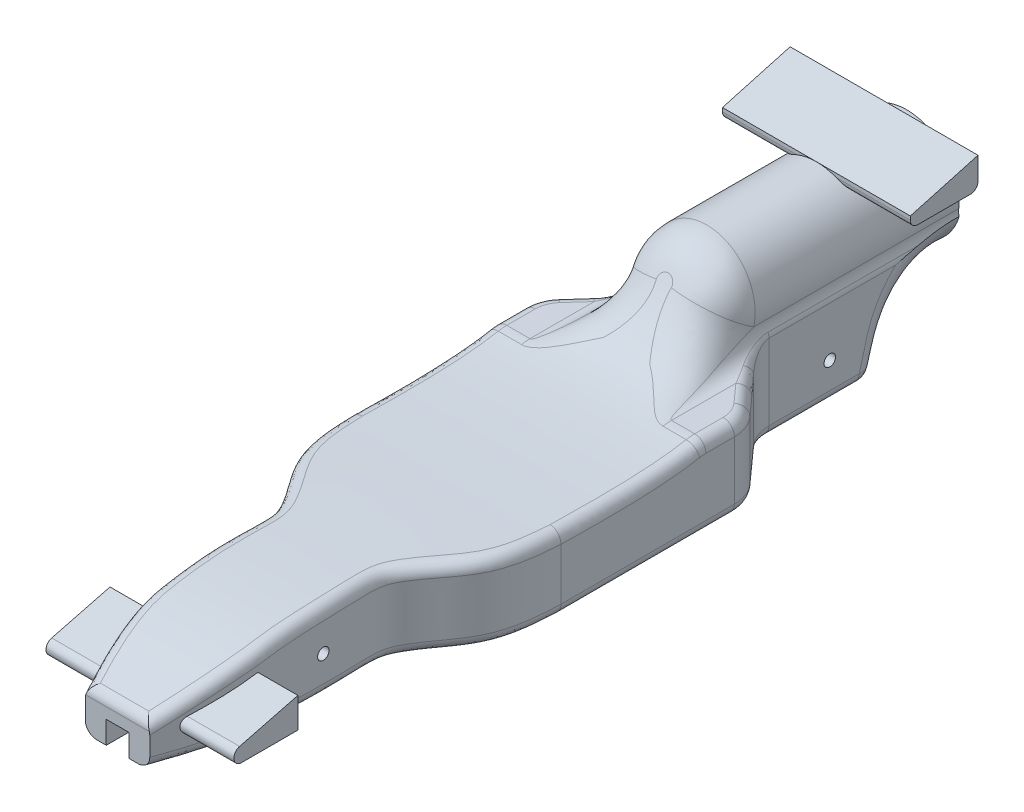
SolidWorks part; units mm, degrees
ref_plane "Front Plane" through (0, 0, 0) normal (0, 0, 1) x (1, 0, 0)
ref_plane "Top Plane" through (0, 0, 0) normal (0, 1, 0) x (1, 0, 0)
ref_plane "Right Plane" through (0, 0, 0) normal (1, 0, 0) x (0, 0, -1)
sketch "Sketch1" plane through (0, 0, 0) normal (0, 0, 1) x (1, 0, 0)
  line L1 (-32.5, 0) -> (32.5, 0)
  line L2 (-32.5, 0) -> (-32.5, 50)
  line L3 (-32.5, 50) -> (32.5, 50)
  line L4 (32.5, 0) -> (32.5, 50)
  dimension "D1" = 65
  dimension "D2" = 50
extrude "Balsa Block" add sketch "Sketch1" along normal blind 223
sketch "Sketch2" plane through (0, 0, 223) normal (0, 0, 1) x (1, 0, 0)
  line L0 (-32.5, 0) -> (32.5, 0) construction
  line L1 (-3, 0) -> (3, 0)
  line L2 (-3, 0) -> (-3, 6)
  line L3 (-3, 6) -> (3, 6)
  line L4 (3, 0) -> (3, 6)
  dimension "D1" = 6
  dimension "D2" = 6
extrude "Screw Eye Slot" cut sketch "Sketch2" against normal through all
sketch "Sketch3" plane through (0, 0, 0) normal (0, 0, -1) x (-1, 0, 0)
  line L0 (32.5, 0) -> (3, 0) construction
  circle A0 centre (0, 29) radius 9.55
  dimension "D1" = 19.1
  dimension "D2" = 29
extrude "CO2 Cartridge Hole" cut sketch "Sketch3" against normal blind 52
sketch "Sketch4" plane through (32.5, 0, 0) normal (1, 0, 0) x (0, 0, -1)
  line L0 (-223, 0) -> (0, 0) construction
  line L1 (0, 0) -> (0, 50) construction
  circle A0 centre (-170, 10) radius 1.525
  circle A1 centre (-35, 10) radius 1.525
  dimension "D4" = 3.05
  dimension "D1" = 10
  dimension "D2" = 135
  dimension "D3" = 35
extrude "Axle Hole Cut Out" cut sketch "Sketch4" against normal through all
sketch "Sketch5" plane through (0, 50, 0) normal (0, 1, 0) x (1, 0, 0)
  line L0 (32.5, 0) -> (-32.5, 0) construction
  line L1 (0, 0) -> (0, -229.7898) construction
  line L2 (-14.55, 0) -> (-14.55, -51.1732)
  line L3 (-17.1047, -57.8491) -> (-25.4453, -67.1509)
  line L4 (-28, -73.8268) -> (-28, -120)
  line L5 (-14.4879, 48.8908) -> (-14.4879, 49.7327) construction
  line L6 (28, -73.8268) -> (28, -120)
  line L7 (17.1047, -57.8491) -> (25.4453, -67.1509)
  line L8 (14.55, 0) -> (14.55, -51.1732)
  line L9 (-14.7766, 49.831) -> (-14.7766, 50.2789) construction
  line L10 (-9.55, 0) -> (-9.55, -52) construction
  line L11 (9.55, -52) -> (9.55, 0) construction
  arc A0 (-25.4453, -67.1509) -> (-28, -73.8268) centre (-18, -73.8268) ccw
  arc A1 (-14.55, -51.1732) -> (-17.1047, -57.8491) centre (-24.55, -51.1732) cw
  arc A2 (14.55, -51.1732) -> (17.1047, -57.8491) centre (24.55, -51.1732) ccw
  arc A3 (25.4453, -67.1509) -> (28, -73.8268) centre (18, -73.8268) cw
  spline S0 degree 3 poles (-28, -120) (-27.6859, -126.0056) (-27.1636, -135.9946) (-19.7034, -144.9636) (-13.3488, -154.8578) (-14.7766, -154.2092) (-14.7766, -173.3072) (-14.4879, -181.2754) (-14.4879, -195.7718) (-8.4397, -210.8954) (-2.3915, -226.019) knots 0 0 0 0 0.179945 0.299298 0.299298 0.625194 0.625194 0.690626 0.690626 1 1 1 1
  spline S1 degree 3 poles (28, -120) (27.6859, -126.0056) (27.1636, -135.9946) (19.7034, -144.9636) (13.3488, -154.8578) (14.7766, -154.2092) (14.7766, -173.3072) (14.4879, -181.2754) (14.4879, -195.7718) (8.4397, -210.8954) (2.3915, -226.019) knots 0 0 0 0 0.179945 0.299298 0.299298 0.625194 0.625194 0.690626 0.690626 1 1 1 1
  spline S2 degree 3 poles (-14.55, 0) (-14.55, -18.3333) (-14.55, -36.6667) (-14.55, -55) knots 0 0 0 0 1 1 1 1
  spline S3 degree 3 poles (14.55, 0) (14.55, -18.3333) (14.55, -36.6667) (14.55, -55) knots 0 0 0 0 1 1 1 1
  dimension "D2" = 5
  dimension "D1" = 5
sketch "Sketch6" plane through (0, 0, 0) normal (1, 0, 0) x (0, 0, -1)
  line L1 (-52, 19.45) -> (0, 19.45) construction
  line L3 (0, 35.543) -> (0, -35.543) construction
  line L10 (-210, 10.9116) -> (-210, 0)
  line L13 (-210, 0) -> (-22.7709, 0)
  spline S0 degree 3 poles (-210, 10.9116) (-202.7227, 13.8598) (-188.783, 19.5071) (-143.7313, 22.444) (-85.5632, 16.1988) (-63.4626, 33.1745) (-61.6089, 55.2214) (-24.8176, 48.2515) (0, 43.55) knots 0 0 0 0 0.060945 0.11674 0.333018 0.333018 0.550088 1 1 1 1
  spline S1 degree 3 poles (-22.7709, 0) (-21.942, 3.2613) (-20.3664, 9.4604) (-11.2641, 16.1435) (-4.1106, 15.068) (0, 14.45) knots 0 0 0 0 0.32075 0.609686 1 1 1 1
  dimension "D3" = 5
  dimension "D1" = 210
  dimension "D2" = 5
sketch "Sketch7" plane through (0, 0, 0) normal (0, 0, -1) x (-1, 0, 0)
  line L0 (18.8348, 21.5) -> (32.5, 21.5)
  line L2 (-18.8348, 21.5) -> (-32.5, 21.5)
  line L5 (0, 0) -> (0, 64.6236) construction
  arc A0 (13.8783, 27.1579) -> (-13.8783, 27.1579) centre (0, 29) ccw
  arc A1 (-13.8783, 27.1579) -> (-18.8348, 21.5) centre (-18.8348, 26.5) cw
  arc A2 (13.8783, 27.1579) -> (18.8348, 21.5) centre (18.8348, 26.5) ccw
  dimension "D1" = 14
  dimension "D3" = 5
  dimension "D2" = 21.5
  dimension "D4" = 65
sketch "Sketch8" plane through (0, 0, 0) normal (1, 0, 0) x (0, 0, -1)
  line L0 (-202.5076, 10) -> (-187, 14)
  line L1 (-187, 14) -> (-187, 6)
  line L2 (-187, 6) -> (-202, 6)
  line L3 (-210, 0) -> (-22.7709, 0) construction
  line L6 (-210, 10.9116) -> (-210, 0) construction
  arc A0 (-202.5076, 10) -> (-202, 6) centre (-202, 8.0322) ccw
  dimension "D1" = 15
  dimension "D2" = 6
  dimension "D3" = 8
  dimension "D4" = 10
  dimension "D5" = 8
extrude "Cut-Extrude1" cut sketch "Sketch5" against normal through all contours S0 L4 A0 L3 A1 L2 M33 M34 M35 | L6 S1 L8 A2 L7 A3 M35 M36 M33
extrude "Cut-Extrude2" cut sketch "Sketch6" against normal through all and the other way through all flip side to cut
extrude "Cut-Extrude3" cut sketch "Sketch7" against normal through all and the other way through all flip side to cut
extrude "Boss-Extrude1" add sketch "Sketch8" along normal mid plane 50
sketch "Sketch9" plane through (0, 0, 0) normal (1, 0, 0) x (0, 0, -1)
  line L0 (-24, 43) -> (-6, 48)
  line L1 (0, 43) -> (-59.8515, 43) construction
  line L2 (-6, 48) -> (-6, 42)
  line L3 (-8, 40) -> (-22, 40)
  line L4 (-24, 42) -> (-24, 43)
  line L5 (0, 27.1579) -> (0, 43) construction
  arc A0 (-6, 42) -> (-8, 40) centre (-8, 42) cw
  arc A1 (-22, 40) -> (-24, 42) centre (-22, 42) cw
  dimension "D1" = 2
  dimension "D2" = 3
  dimension "D3" = 8
  dimension "D4" = 18
  dimension "D5" = 6
extrude "Boss-Extrude2" add sketch "Sketch9" along normal mid plane 50
fillet "Fillet1" radius 3 29 edges at (-14.55, 0, 36.9721) (-15.2105, 0, 54.7472) (-21.275, 0, 62.5) (-27.3395, 0, 70.2528) (-28, 0, 96.9134) (15.2105, 0, 54.7472) (14.55, 0, 36.9721) (21.275, 0, 62.5) (27.3395, 0, 70.2528) (28, 0, 96.9134) (0, 10.9116, 210) (-14.55, 23.9231, 25.5866) (-14.7762, 23.5797, 53.2883) (-17.9561, 21.5778, 58.7986) (-22.14, 21.5, 63.4647) (-27.3395, 21.5, 70.2528) (-28, 21.5, 78.2147) (-15.33, 20.6441, 152.4527) (14.55, 23.9231, 25.5866) (14.7762, 23.5797, 53.2883) (17.9561, 21.5778, 58.7986) (22.14, 21.5, 63.4647) (27.3395, 21.5, 70.2528) (28, 21.5, 78.2147) (15.33, 20.6441, 152.4527)
fillet "Fillet2" radius 12 7 edges at (-26.8663, 20.8488, 82.5337) (26.8663, 20.8488, 82.5337) (21.9174, 21.5, 82.6025) (17.1807, 21.7815, 81.3793) (-21.9174, 21.5, 82.6025) (-17.3362, 21.7299, 81.5913) (0.0541, 42.9999, 59.8516)
fillet "VarFillet1" radius 15 2 edges
